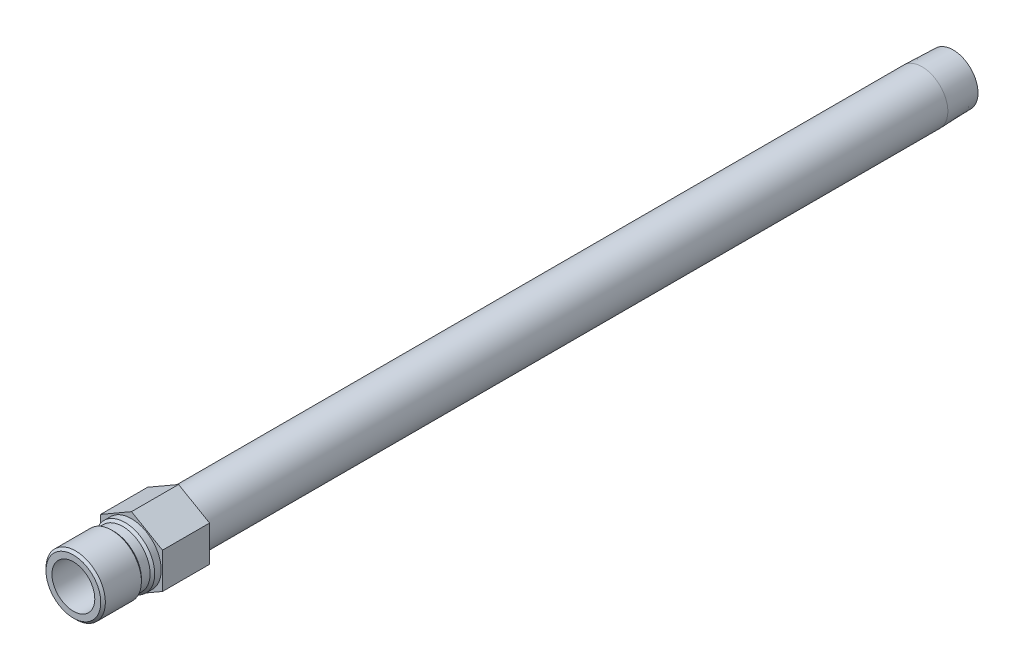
SolidWorks part; units mm, degrees
ref_plane "Front Plane" through (0, 0, 0) normal (0, 0, 1) x (1, 0, 0)
ref_plane "Top Plane" through (0, 0, 0) normal (0, 1, 0) x (1, 0, 0)
ref_plane "Right Plane" through (0, 0, 0) normal (1, 0, 0) x (0, 0, -1)
sketch "Sketch1" plane through (0, 0, 0) normal (1, 0, 0) x (0, 0, -1)
  line L0 (0, 0) -> (-22.479, 0) construction
  line L1 (-19.304, 7.112) -> (-19.304, 9.0932)
  line L2 (-5.8166, 9.0932) -> (-5.8166, 0) construction
  line L3 (-18.542, 9.8552) -> (-6.5786, 9.8552)
  line L4 (0, 8.5725) -> (0, 0) construction
  line L5 (-5.8166, 9.0932) -> (-2.921, 9.0932)
  line L6 (-2.159, 9.8552) -> (0, 9.8552)
  line L7 (0, 9.8552) -> (0, 8.5725)
  line L8 (-5.8166, 9.0932) -> (-6.5786, 9.8552)
  line L9 (-2.921, 9.0932) -> (-2.159, 9.8552)
  line L10 (-19.304, 9.0932) -> (-18.542, 9.8552)
  line L11 (-19.304, 7.112) -> (-1.524, 7.112)
  line L12 (0, 8.5725) -> (262.4582, 8.5725)
  line L13 (262.4582, 8.5725) -> (272.796, 8.2494)
  line L14 (272.796, 8.2494) -> (272.796, 6.2611)
  line L15 (0, 9.8552) -> (15.621, 9.8552) construction
  line L16 (15.621, 9.8552) -> (15.621, 0) construction
  line L17 (15.621, 0) -> (0, 0) construction
  line L18 (-1.0716, 6.2611) -> (-1.524, 7.112)
  line L19 (-1.0716, 6.2611) -> (272.796, 6.2611)
  dimension "D1" = 19.304
  dimension "D2" = 2.8956
  dimension "D3" = 0.762
  dimension "D4" = 45
  dimension "D5" = 13.4874
  dimension "D6" = 45
  dimension "D7" = 1.79
  dimension "D8" = 10.3378
  dimension "D9" = 292.1
  dimension "D10" = 3.175
  dimension "D11" = 34.925
  dimension "D12" = 14.224
  dimension "D13" = 17.145
  dimension "D14" = 19.7104
  dimension "D15" = 12.5222
  dimension "D16" = 118
  dimension "D17" = 17.78
revolve "Revolve1" add sketch "Sketch1" angle 360 about L0
sketch "Sketch2" plane through (0, 0, 0) normal (0, 0, 1) x (1, 0, 0)
  line L1 (-10.287, 5.9392) -> (-10.287, -5.9392)
  line L2 (-10.287, -5.9392) -> (0, -11.8784)
  line L3 (0, -11.8784) -> (10.287, -5.9392)
  line L4 (10.287, -5.9392) -> (10.287, 5.9392)
  line L5 (10.287, 5.9392) -> (0, 11.8784)
  line L6 (0, 11.8784) -> (-10.287, 5.9392)
  circle A0 centre (0, 0) radius 10.287 construction
  circle A1 centre (0, 0) radius 7.112 construction
  circle A2 centre (0, 0) radius 7.112
  dimension "D1" = 20.574
extrude "Boss-Extrude1" add sketch "Sketch2" against normal up to vertex (15.621 mm away) from vertex at 0
